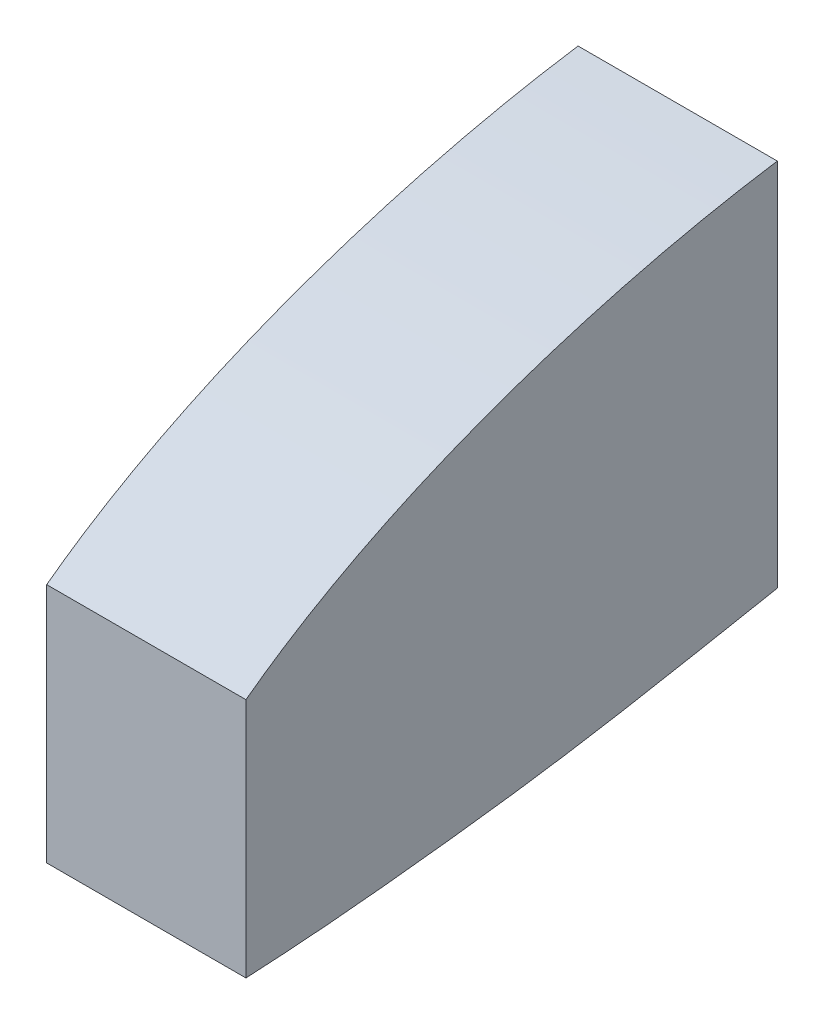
SolidWorks part; units mm, degrees
ref_plane "Front Plane" through (0, 0, 0) normal (0, 0, 1) x (1, 0, 0)
ref_plane "Top Plane" through (0, 0, 0) normal (0, 1, 0) x (1, 0, 0)
ref_plane "Right Plane" through (0, 0, 0) normal (1, 0, 0) x (0, 0, -1)
curve "Curve1"
sketch "Sketch1" plane through (0, 0, 0) normal (1, 0, 0) x (0, 0, -1)
  line L1 (0, 0) -> (0, 95.7684) construction
  line L2 (6.35, 9.3114) -> (6.35, -2.2105)
  line L3 (31.75, 18.9087) -> (31.75, 1.2273)
  spline S0 degree 3 poles (31.75, 18.9087) (30.8282, 18.7681) (28.6506, 18.394) (25.298, 17.6485) (21.7622, 16.6729) (18.4462, 15.5708) (15.3642, 14.3678) (12.5354, 13.0705) (9.9687, 11.7051) (7.9333, 10.4453) (6.7708, 9.6244) (6.35, 9.3114) knots 1.383512 1.383512 1.383512 1.383512 1.392653 1.40517 1.417172 1.428604 1.439419 1.449597 1.459102 1.467908 1.473049 1.473049 1.473049 1.473049
  spline S1 degree 3 poles (6.35, -2.2105) (6.4866, -2.2038) (7.5655, -2.1482) (9.7294, -2.0053) (12.9698, -1.707) (16.6023, -1.3031) (20.609, -0.785) (24.9881, -0.0604) (28.7373, 0.6535) (31.0395, 1.0921) (31.75, 1.2273) knots 0.536375 0.536375 0.536375 0.536375 0.537716 0.546968 0.557637 0.56962 0.582804 0.597247 0.613135 0.620227 0.620227 0.620227 0.620227
  dimension "D2" = 6.35
  dimension "D3" = 31.75
extrude "Boss-Extrude1" add sketch "Sketch1" along normal blind 9.525
